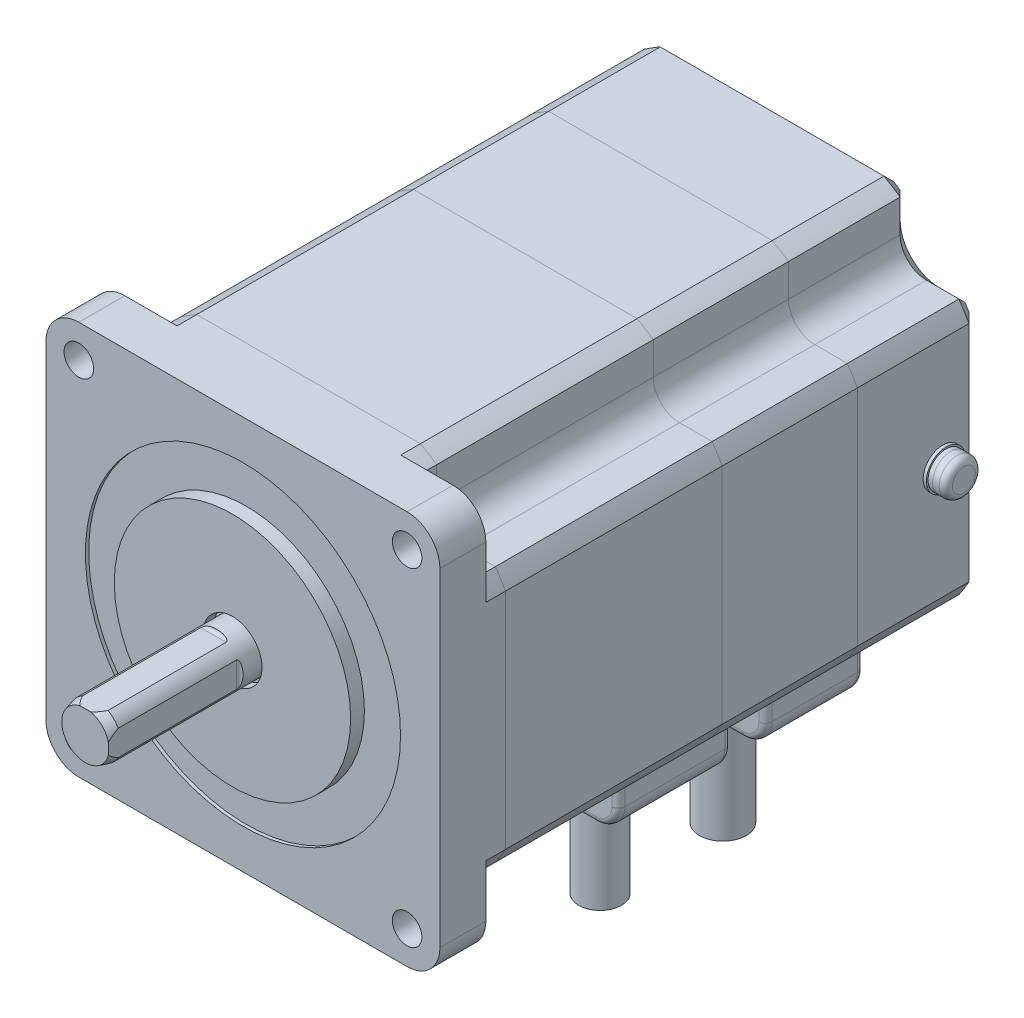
SolidWorks part; units mm, degrees
ref_plane "正面" through (0, 0, 0) normal (0, 0, 1) x (1, 0, 0)
ref_plane "平面" through (0, 0, 0) normal (0, 1, 0) x (1, 0, 0)
ref_plane "右側面" through (0, 0, 0) normal (1, 0, 0) x (0, 0, -1)
sketch "ｽｹｯﾁ1" plane through (0, 0, 0) normal (0, 0, 1) x (1, 0, 0)
  line L0 (30, 19.5) -> (-30, -19.5) construction
  line L1 (-28.4605, 19.5) -> (-23.5, 19.5)
  line L2 (-30, 17.0367) -> (-30, -17.0367)
  line L3 (-28.4605, -19.5) -> (-23.5, -19.5)
  line L4 (30, 17.0367) -> (30, -17.0367)
  line L5 (19.5, 30) -> (-19.5, -30) construction
  line L6 (-17.0367, 30) -> (17.0367, 30)
  line L7 (-19.5, 28.4605) -> (-19.5, 23.5)
  line L8 (-17.0367, -30) -> (17.0367, -30)
  line L9 (19.5, 28.4605) -> (19.5, 23.5)
  line L10 (-19.5, -23.5) -> (-19.5, -28.4605)
  line L11 (23.5, 19.5) -> (28.4605, 19.5)
  line L12 (19.5, -23.5) -> (19.5, -28.4605)
  line L13 (23.5, -19.5) -> (28.4605, -19.5)
  line L14 (0, 0) -> (-34.0949, 0) construction
  line L15 (-34.0949, 0) -> (0, 0) construction
  line L16 (0, 0) -> (0, 27.8714) construction
  line L17 (0, 0) -> (-26.7983, 26.7983) construction
  line L18 (0, 0) -> (-19.8321, 32.9149) construction
  arc A0 (-17.0367, 30) -> (-19.5, 28.4605) centre (0, 0) ccw
  arc A1 (-19.5, 23.5) -> (-23.5, 19.5) centre (-23.5, 23.5) cw
  arc A2 (23.5, 19.5) -> (19.5, 23.5) centre (23.5, 23.5) cw
  arc A3 (23.5, -19.5) -> (19.5, -23.5) centre (23.5, -23.5) ccw
  arc A4 (-23.5, -19.5) -> (-19.5, -23.5) centre (-23.5, -23.5) cw
  arc A5 (-28.4605, 19.5) -> (-30, 17.0367) centre (0, 0) ccw
  arc A6 (-30, -17.0367) -> (-28.4605, -19.5) centre (0, 0) ccw
  arc A7 (-19.5, -28.4605) -> (-17.0367, -30) centre (0, 0) ccw
  arc A8 (17.0367, -30) -> (19.5, -28.4605) centre (0, 0) ccw
  arc A9 (28.4605, -19.5) -> (30, -17.0367) centre (0, 0) ccw
  arc A10 (30, 17.0367) -> (28.4605, 19.5) centre (0, 0) ccw
  arc A11 (19.5, 28.4605) -> (17.0367, 30) centre (0, 0) ccw
  circle A12 centre (0, 0) radius 31 construction
  circle A13 centre (-15.9986, 26.5527) radius 1.65 construction
  circle A14 centre (-26.5527, 15.9986) radius 1.65 construction
  circle A15 centre (26.5527, 15.9986) radius 1.65 construction
  circle A16 centre (15.9986, 26.5527) radius 1.65 construction
  circle A17 centre (26.5527, -15.9986) radius 1.65 construction
  circle A18 centre (15.9986, -26.5527) radius 1.65 construction
  circle A19 centre (-26.5527, -15.9986) radius 1.65 construction
  circle A20 centre (-15.9986, -26.5527) radius 1.65 construction
  circle A21 centre (0, 0) radius 4.5
  point P21 (19.5, -19.5)
  dimension "D2" = 69
  dimension "D6" = 4
  dimension "D1" = 62
  dimension "D3" = 13.93
  dimension "D5" = 9
  dimension "D4" = 3.3
extrude "押し出し1" add sketch "ｽｹｯﾁ1" along normal blind 3
sketch "ｽｹｯﾁ2" plane through (0, 0, 3) normal (0, 0, 1) x (1, 0, 0)
  line L0 (-32.2592, 0) -> (33.9843, 0) construction
  line L1 (0, 32.3282) -> (0, -33.0873) construction
  line L2 (30, 30) -> (-30, -30) construction
  line L3 (-25, 30) -> (25, 30)
  line L4 (-30, 25) -> (-30, -25)
  line L5 (-25, -30) -> (25, -30)
  line L6 (30, 25) -> (30, -25)
  line L7 (-42.7915, 16) -> (47.6797, 16) construction
  line L8 (-40.9293, 25) -> (35.2652, 25) construction
  circle A0 centre (25, 25) radius 2.25
  circle A1 centre (0, 0) radius 31 construction
  circle A2 centre (-25, -25) radius 2.25
  circle A3 centre (-26.5518, 16) radius 1.65 construction
  circle A4 centre (25, -25) radius 2.25
  circle A5 centre (-26.5518, -16) radius 1.65 construction
  circle A6 centre (-25, 25) radius 2.25
  circle A7 centre (26.5518, -16) radius 1.65 construction
  circle A8 centre (26.5518, 16) radius 1.65 construction
  arc A10 (-25, 30) -> (-30, 25) centre (-25, 25) ccw
  arc A11 (30, 25) -> (25, 30) centre (25, 25) ccw
  arc A12 (30, -25) -> (25, -30) centre (25, -25) cw
  arc A13 (-30, -25) -> (-25, -30) centre (-25, -25) ccw
  point P35 (-30, 30)
  dimension "D3" = 4.5
  dimension "D4" = 62
  dimension "D5" = 16
  dimension "D8" = 3.3
  dimension "D9" = 5
  dimension "D1" = 60
  dimension "D2" = 60
  dimension "D6" = 25
extrude "押し出し2" add sketch "ｽｹｯﾁ2" along normal blind 7
sketch "ｽｹｯﾁ3" plane through (0, 0, 10) normal (0, 0, 1) x (1, 0, 0)
  circle A0 centre (0, 0) radius 4.5
  circle A1 centre (0, 0) radius 18
  dimension "D1" = 36
extrude "押し出し3" add sketch "ｽｹｯﾁ3" along normal blind 1.6
sketch "ｽｹｯﾁ4" plane through (0, 0, 10) normal (0, 0, 1) x (1, 0, 0)
  circle A0 centre (0, 0) radius 18
  circle A1 centre (0, 0) radius 24
  circle A2 centre (0, 0) radius 18 construction
  circle A3 centre (0, 0) radius 18 construction
  dimension "D1" = 48
extrude "押し出し4" cut sketch "ｽｹｯﾁ4" against normal blind 0.5
sketch "ｽｹｯﾁ7" plane through (0, 0, 0) normal (0, 0, -1) x (-1, 0, 0)
  line L12 (-19.5, 28.4605) -> (-19.5, 23.5)
  line L13 (-23.5, 19.5) -> (-28.4605, 19.5)
  line L14 (-30, 17.0367) -> (-30, -17.0367)
  line L15 (-28.4605, -19.5) -> (-23.5, -19.5)
  line L16 (-19.5, -23.5) -> (-19.5, -28.4605)
  line L17 (-17.0367, -30) -> (17.0367, -30)
  line L18 (19.5, -28.4605) -> (19.5, -23.5)
  line L19 (23.5, -19.5) -> (28.4605, -19.5)
  line L20 (30, -17.0367) -> (30, 17.0367)
  line L21 (28.4605, 19.5) -> (23.5, 19.5)
  line L22 (19.5, 23.5) -> (19.5, 28.4605)
  line L23 (17.0367, 30) -> (-17.0367, 30)
  line L24 (-19.5, 28.4605) -> (-19.5, 23.5)
  line L25 (-23.5, 19.5) -> (-28.4605, 19.5)
  line L26 (-30, 17.0367) -> (-30, -17.0367)
  line L27 (-28.4605, -19.5) -> (-23.5, -19.5)
  line L28 (-19.5, -23.5) -> (-19.5, -28.4605)
  line L29 (-17.0367, -30) -> (17.0367, -30)
  line L30 (19.5, -28.4605) -> (19.5, -23.5)
  line L31 (23.5, -19.5) -> (28.4605, -19.5)
  line L32 (30, -17.0367) -> (30, 17.0367)
  line L33 (28.4605, 19.5) -> (23.5, 19.5)
  line L34 (19.5, 23.5) -> (19.5, 28.4605)
  line L35 (17.0367, 30) -> (-17.0367, 30)
  arc A12 (-17.0367, 30) -> (-19.5, 28.4605) centre (0, 0) ccw
  arc A13 (-23.5, 19.5) -> (-19.5, 23.5) centre (-23.5, 23.5) ccw
  arc A14 (-28.4605, 19.5) -> (-30, 17.0367) centre (0, 0) ccw
  arc A15 (-30, -17.0367) -> (-28.4605, -19.5) centre (0, 0) ccw
  arc A16 (-19.5, -23.5) -> (-23.5, -19.5) centre (-23.5, -23.5) ccw
  arc A17 (-19.5, -28.4605) -> (-17.0367, -30) centre (0, 0) ccw
  arc A18 (17.0367, -30) -> (19.5, -28.4605) centre (0, 0) ccw
  arc A19 (23.5, -19.5) -> (19.5, -23.5) centre (23.5, -23.5) ccw
  arc A20 (28.4605, -19.5) -> (30, -17.0367) centre (0, 0) ccw
  arc A21 (30, 17.0367) -> (28.4605, 19.5) centre (0, 0) ccw
  arc A22 (19.5, 23.5) -> (23.5, 19.5) centre (23.5, 23.5) ccw
  arc A23 (19.5, 28.4605) -> (17.0367, 30) centre (0, 0) ccw
  arc A24 (-17.0367, 30) -> (-19.5, 28.4605) centre (0, 0) ccw
  arc A25 (-23.5, 19.5) -> (-19.5, 23.5) centre (-23.5, 23.5) ccw
  arc A26 (-28.4605, 19.5) -> (-30, 17.0367) centre (0, 0) ccw
  arc A27 (-30, -17.0367) -> (-28.4605, -19.5) centre (0, 0) ccw
  arc A28 (-19.5, -23.5) -> (-23.5, -19.5) centre (-23.5, -23.5) ccw
  arc A29 (-19.5, -28.4605) -> (-17.0367, -30) centre (0, 0) ccw
  arc A30 (17.0367, -30) -> (19.5, -28.4605) centre (0, 0) ccw
  arc A31 (23.5, -19.5) -> (19.5, -23.5) centre (23.5, -23.5) ccw
  arc A32 (28.4605, -19.5) -> (30, -17.0367) centre (0, 0) ccw
  arc A33 (30, 17.0367) -> (28.4605, 19.5) centre (0, 0) ccw
  arc A34 (19.5, 23.5) -> (23.5, 19.5) centre (23.5, 23.5) ccw
  arc A35 (19.5, 28.4605) -> (17.0367, 30) centre (0, 0) ccw
  dimension "D1" = 0
extrude "ﾎﾞｽ - 押し出し1" add sketch "ｽｹｯﾁ7" along normal blind 33 separate body
sketch "ｽｹｯﾁ8" plane through (0, 0, -33) normal (0, 0, -1) x (-1, 0, 0)
  line L12 (-19.5, 28.4605) -> (-19.5, 23.5)
  line L13 (-23.5, 19.5) -> (-28.4605, 19.5)
  line L14 (-30, 17.0367) -> (-30, -17.0367)
  line L15 (-28.4605, -19.5) -> (-23.5, -19.5)
  line L16 (-19.5, -23.5) -> (-19.5, -28.4605)
  line L17 (-17.0367, -30) -> (17.0367, -30)
  line L18 (19.5, -28.4605) -> (19.5, -23.5)
  line L19 (23.5, -19.5) -> (28.4605, -19.5)
  line L20 (30, -17.0367) -> (30, 17.0367)
  line L21 (28.4605, 19.5) -> (23.5, 19.5)
  line L22 (19.5, 23.5) -> (19.5, 28.4605)
  line L23 (17.0367, 30) -> (-17.0367, 30)
  line L24 (-19.5, 28.4605) -> (-19.5, 23.5)
  line L25 (-23.5, 19.5) -> (-28.4605, 19.5)
  line L26 (-30, 17.0367) -> (-30, -17.0367)
  line L27 (-28.4605, -19.5) -> (-23.5, -19.5)
  line L28 (-19.5, -23.5) -> (-19.5, -28.4605)
  line L29 (-17.0367, -30) -> (17.0367, -30)
  line L30 (19.5, -28.4605) -> (19.5, -23.5)
  line L31 (23.5, -19.5) -> (28.4605, -19.5)
  line L32 (30, -17.0367) -> (30, 17.0367)
  line L33 (28.4605, 19.5) -> (23.5, 19.5)
  line L34 (19.5, 23.5) -> (19.5, 28.4605)
  line L35 (17.0367, 30) -> (-17.0367, 30)
  arc A12 (-17.0367, 30) -> (-19.5, 28.4605) centre (0, 0) ccw
  arc A13 (-23.5, 19.5) -> (-19.5, 23.5) centre (-23.5, 23.5) ccw
  arc A14 (-28.4605, 19.5) -> (-30, 17.0367) centre (0, 0) ccw
  arc A15 (-30, -17.0367) -> (-28.4605, -19.5) centre (0, 0) ccw
  arc A16 (-19.5, -23.5) -> (-23.5, -19.5) centre (-23.5, -23.5) ccw
  arc A17 (-19.5, -28.4605) -> (-17.0367, -30) centre (0, 0) ccw
  arc A18 (17.0367, -30) -> (19.5, -28.4605) centre (0, 0) ccw
  arc A19 (23.5, -19.5) -> (19.5, -23.5) centre (23.5, -23.5) ccw
  arc A20 (28.4605, -19.5) -> (30, -17.0367) centre (0, 0) ccw
  arc A21 (30, 17.0367) -> (28.4605, 19.5) centre (0, 0) ccw
  arc A22 (19.5, 23.5) -> (23.5, 19.5) centre (23.5, 23.5) ccw
  arc A23 (19.5, 28.4605) -> (17.0367, 30) centre (0, 0) ccw
  arc A24 (-17.0367, 30) -> (-19.5, 28.4605) centre (0, 0) ccw
  arc A25 (-23.5, 19.5) -> (-19.5, 23.5) centre (-23.5, 23.5) ccw
  arc A26 (-28.4605, 19.5) -> (-30, 17.0367) centre (0, 0) ccw
  arc A27 (-30, -17.0367) -> (-28.4605, -19.5) centre (0, 0) ccw
  arc A28 (-19.5, -23.5) -> (-23.5, -19.5) centre (-23.5, -23.5) ccw
  arc A29 (-19.5, -28.4605) -> (-17.0367, -30) centre (0, 0) ccw
  arc A30 (17.0367, -30) -> (19.5, -28.4605) centre (0, 0) ccw
  arc A31 (23.5, -19.5) -> (19.5, -23.5) centre (23.5, -23.5) ccw
  arc A32 (28.4605, -19.5) -> (30, -17.0367) centre (0, 0) ccw
  arc A33 (30, 17.0367) -> (28.4605, 19.5) centre (0, 0) ccw
  arc A34 (19.5, 23.5) -> (23.5, 19.5) centre (23.5, 23.5) ccw
  arc A35 (19.5, 28.4605) -> (17.0367, 30) centre (0, 0) ccw
  dimension "D1" = 0
extrude "ﾎﾞｽ - 押し出し2" add sketch "ｽｹｯﾁ8" along normal blind 20.6 separate body
sketch "ｽｹｯﾁ9" plane through (0, 0, -53.6) normal (0, 0, -1) x (-1, 0, 0)
  line L12 (-19.5, 28.4605) -> (-19.5, 23.5)
  line L13 (-23.5, 19.5) -> (-28.4605, 19.5)
  line L14 (-30, 17.0367) -> (-30, -17.0367)
  line L15 (-28.4605, -19.5) -> (-23.5, -19.5)
  line L16 (-19.5, -23.5) -> (-19.5, -28.4605)
  line L17 (-17.0367, -30) -> (17.0367, -30)
  line L18 (19.5, -28.4605) -> (19.5, -23.5)
  line L19 (23.5, -19.5) -> (28.4605, -19.5)
  line L20 (30, -17.0367) -> (30, 17.0367)
  line L21 (28.4605, 19.5) -> (23.5, 19.5)
  line L22 (19.5, 23.5) -> (19.5, 28.4605)
  line L23 (17.0367, 30) -> (-17.0367, 30)
  line L24 (-19.5, 28.4605) -> (-19.5, 23.5)
  line L25 (-23.5, 19.5) -> (-28.4605, 19.5)
  line L26 (-30, 17.0367) -> (-30, -17.0367)
  line L27 (-28.4605, -19.5) -> (-23.5, -19.5)
  line L28 (-19.5, -23.5) -> (-19.5, -28.4605)
  line L29 (-17.0367, -30) -> (17.0367, -30)
  line L30 (19.5, -28.4605) -> (19.5, -23.5)
  line L31 (23.5, -19.5) -> (28.4605, -19.5)
  line L32 (30, -17.0367) -> (30, 17.0367)
  line L33 (28.4605, 19.5) -> (23.5, 19.5)
  line L34 (19.5, 23.5) -> (19.5, 28.4605)
  line L35 (17.0367, 30) -> (-17.0367, 30)
  arc A12 (-17.0367, 30) -> (-19.5, 28.4605) centre (0, 0) ccw
  arc A13 (-23.5, 19.5) -> (-19.5, 23.5) centre (-23.5, 23.5) ccw
  arc A14 (-28.4605, 19.5) -> (-30, 17.0367) centre (0, 0) ccw
  arc A15 (-30, -17.0367) -> (-28.4605, -19.5) centre (0, 0) ccw
  arc A16 (-19.5, -23.5) -> (-23.5, -19.5) centre (-23.5, -23.5) ccw
  arc A17 (-19.5, -28.4605) -> (-17.0367, -30) centre (0, 0) ccw
  arc A18 (17.0367, -30) -> (19.5, -28.4605) centre (0, 0) ccw
  arc A19 (23.5, -19.5) -> (19.5, -23.5) centre (23.5, -23.5) ccw
  arc A20 (28.4605, -19.5) -> (30, -17.0367) centre (0, 0) ccw
  arc A21 (30, 17.0367) -> (28.4605, 19.5) centre (0, 0) ccw
  arc A22 (19.5, 23.5) -> (23.5, 19.5) centre (23.5, 23.5) ccw
  arc A23 (19.5, 28.4605) -> (17.0367, 30) centre (0, 0) ccw
  arc A24 (-17.0367, 30) -> (-19.5, 28.4605) centre (0, 0) ccw
  arc A25 (-23.5, 19.5) -> (-19.5, 23.5) centre (-23.5, 23.5) ccw
  arc A26 (-28.4605, 19.5) -> (-30, 17.0367) centre (0, 0) ccw
  arc A27 (-30, -17.0367) -> (-28.4605, -19.5) centre (0, 0) ccw
  arc A28 (-19.5, -23.5) -> (-23.5, -19.5) centre (-23.5, -23.5) ccw
  arc A29 (-19.5, -28.4605) -> (-17.0367, -30) centre (0, 0) ccw
  arc A30 (17.0367, -30) -> (19.5, -28.4605) centre (0, 0) ccw
  arc A31 (23.5, -19.5) -> (19.5, -23.5) centre (23.5, -23.5) ccw
  arc A32 (28.4605, -19.5) -> (30, -17.0367) centre (0, 0) ccw
  arc A33 (30, 17.0367) -> (28.4605, 19.5) centre (0, 0) ccw
  arc A34 (19.5, 23.5) -> (23.5, 19.5) centre (23.5, 23.5) ccw
  arc A35 (19.5, 28.4605) -> (17.0367, 30) centre (0, 0) ccw
  dimension "D1" = 0
extrude "ﾎﾞｽ - 押し出し3" add sketch "ｽｹｯﾁ9" along normal blind 19 separate body
sketch "ｽｹｯﾁ10" plane through (0, 0, 0) normal (0, 0, 1) x (1, 0, 0)
  circle A0 centre (0, 0) radius 4
  dimension "D1" = 8
extrude "ﾎﾞｽ - 押し出し6" add sketch "ｽｹｯﾁ10" along normal blind 34 separate body
sketch "ｽｹｯﾁ11" plane through (0, 0, 34) normal (0, 0, 1) x (1, 0, 0)
  line L1 (-4.7031, 6.447) -> (4.0819, 6.447)
  line L2 (-4.7031, 6.447) -> (-4.7031, 3.5)
  line L3 (-4.7031, 3.5) -> (4.0819, 3.5)
  line L4 (4.0819, 6.447) -> (4.0819, 3.5)
  line L5 (5.7984, 2.1399) -> (3.5, 2.1399)
  line L6 (5.7984, 2.1399) -> (5.7984, -3.8792)
  line L7 (5.7984, -3.8792) -> (3.5, -3.8792)
  line L8 (3.5, 2.1399) -> (3.5, -3.8792)
  dimension "D1" = 3.5
  dimension "D2" = 3.5
extrude "ｶｯﾄ - 押し出し1" cut sketch "ｽｹｯﾁ11" against normal blind 20
fillet "ﾌｨﾚｯﾄ1" radius 0.5 2 edges at (3.5, 0, 14) (0, 3.5, 14)
sketch "ｽｹｯﾁ12" plane through (30, 0, 0) normal (1, 0, 0) x (0, 0, -1)
  line L0 (72.6, 17.0367) -> (72.6, -17.0367) construction
  circle A0 centre (66.6, 0) radius 3
  dimension "D1" = 6
  dimension "D2" = 6
extrude "ﾎﾞｽ - 押し出し7" add sketch "ｽｹｯﾁ12" along normal blind 0.5 separate body
sketch "ｽｹｯﾁ13" plane through (30.5, 0, 0) normal (1, 0, 0) x (0, 0, -1)
  circle A0 centre (66.6, 0) radius 2.75
  dimension "D1" = 5.5
extrude "ﾎﾞｽ - 押し出し8" add sketch "ｽｹｯﾁ13" along normal blind 0.7
sketch "ｽｹｯﾁ14" plane through (31.2, 0, 0) normal (1, 0, 0) x (0, 0, -1)
  circle A0 centre (66.6, 0) radius 2.75
extrude "ﾎﾞｽ - 押し出し9" add sketch "ｽｹｯﾁ14" along normal blind 2 separate body
fillet "ﾌｨﾚｯﾄ3" radius 1 1 edges at (33.2, 2.75, -66.6)
chamfer "面取り1" distance 2 angle 45 24 edges at (-19.5, 25.9802, -72.6) (-20.6716, 20.6716, -72.6) (-25.9802, 19.5, -72.6) (-29.2562, 18.2846, -72.6) (-30, 0, -72.6) (-29.2562, -18.2846, -72.6) (-25.9802, -19.5, -72.6) (-20.6716, -20.6716, -72.6) (-19.5, -25.9802, -72.6) (-18.2846, -29.2562, -72.6) (0, -30, -72.6) (18.2846, -29.2562, -72.6) (25.9802, 19.5, -72.6) (20.6716, 20.6716, -72.6) (-18.2846, 29.2562, -72.6) (19.5, 25.9802, -72.6) (18.2846, 29.2562, -72.6) (0, 30, -72.6) (19.5, -25.9802, -72.6) (20.6716, -20.6716, -72.6) (25.9802, -19.5, -72.6) (29.2562, -18.2846, -72.6) (29.2562, 18.2846, -72.6) (30, 0, -72.6)
sketch "ｽｹｯﾁ15" plane through (0, -30, 0) normal (0, -1, 0) x (1, 0, 0)
  line L0 (16.5, -72.6) -> (-16.5, -72.6) construction
  line L1 (-14, -55.6) -> (14, -55.6)
  line L2 (-14, -55.6) -> (-14, -70.6)
  line L3 (-14, -70.6) -> (14, -70.6)
  line L4 (14, -55.6) -> (14, -70.6)
  line L5 (-14, -55.6) -> (14, -70.6) construction
  line L6 (-14, -70.6) -> (14, -55.6) construction
  line L8 (-14, -33.2) -> (14, -33.2)
  line L9 (-14, -33.2) -> (-14, -50.4)
  line L10 (-14, -50.4) -> (14, -50.4)
  line L11 (14, -33.2) -> (14, -50.4)
  line L12 (-14, -33.2) -> (14, -50.4) construction
  line L13 (-14, -50.4) -> (14, -33.2) construction
  point P0 (0, -63.1)
  point P5 (0, -72.6)
  point P10 (0, -41.8)
  dimension "D1" = 2
  dimension "D2" = 15
  dimension "D3" = 28
  dimension "D4" = 28
  dimension "D5" = 22.2
  dimension "D6" = 17.2
extrude "ﾎﾞｽ - 押し出し10" add sketch "ｽｹｯﾁ15" along normal blind 10 separate body
fillet "ﾌｨﾚｯﾄ4" radius 3.5 2 edges at (-14, -40, -41.8) (14, -40, -41.8)
fillet "ﾌｨﾚｯﾄ5" radius 3.5 2 edges at (14, -40, -63.1) (-14, -40, -63.1)
fillet "ﾌｨﾚｯﾄ6" radius 1 10 edges at (-14, -33.25, -50.4) (-12.9749, -38.9749, -50.4) (14, -33.25, -50.4) (12.9749, -38.9749, -50.4) (14, -33.25, -33.2) (12.9749, -38.9749, -33.2) (-14, -33.25, -33.2) (-12.9749, -38.9749, -33.2) (0, -40, -50.4) (0, -40, -33.2)
fillet "ﾌｨﾚｯﾄ7" radius 1 10 edges at (-14, -33.25, -70.6) (-12.9749, -38.9749, -70.6) (14, -33.25, -70.6) (12.9749, -38.9749, -70.6) (14, -33.25, -55.6) (12.9749, -38.9749, -55.6) (-14, -33.25, -55.6) (-12.9749, -38.9749, -55.6) (0, -40, -70.6) (0, -40, -55.6)
sketch "ｽｹｯﾁ16" plane through (0, -40, 0) normal (0, -1, 0) x (1, 0, 0)
  line L0 (16.5, -72.6) -> (-16.5, -72.6) construction
  circle A0 centre (0, -63.1) radius 3.55
  circle A1 centre (0, -44.4) radius 3.25
  dimension "D1" = 7.1
  dimension "D4" = 6.5
  dimension "D2" = 9.5
  dimension "D3" = 28.2
extrude "ﾎﾞｽ - 押し出し11" add sketch "ｽｹｯﾁ16" along normal blind 20
sketch "ｽｹｯﾁ17" plane through (0, 0, 0) normal (1, 0, 0) x (0, 0, -1)
  line L0 (0, 0) -> (-44.0022, 0) construction
  line L1 (0, -17.0367) -> (0, 17.0367) construction
  line L2 (-34, -3.5981) -> (-34, -4)
  line L3 (-34, 3.5) -> (-34, -4) construction
  line L4 (-34, -4) -> (-32.5, -4)
  line L5 (-32.5, -4) -> (-34, -3.5981)
  dimension "D1" = 1.5
  dimension "D2" = 15
  dimension "D3" = 4
revolve "ｶｯﾄ - 回転1" cut sketch "ｽｹｯﾁ17" angle 360 about L0
